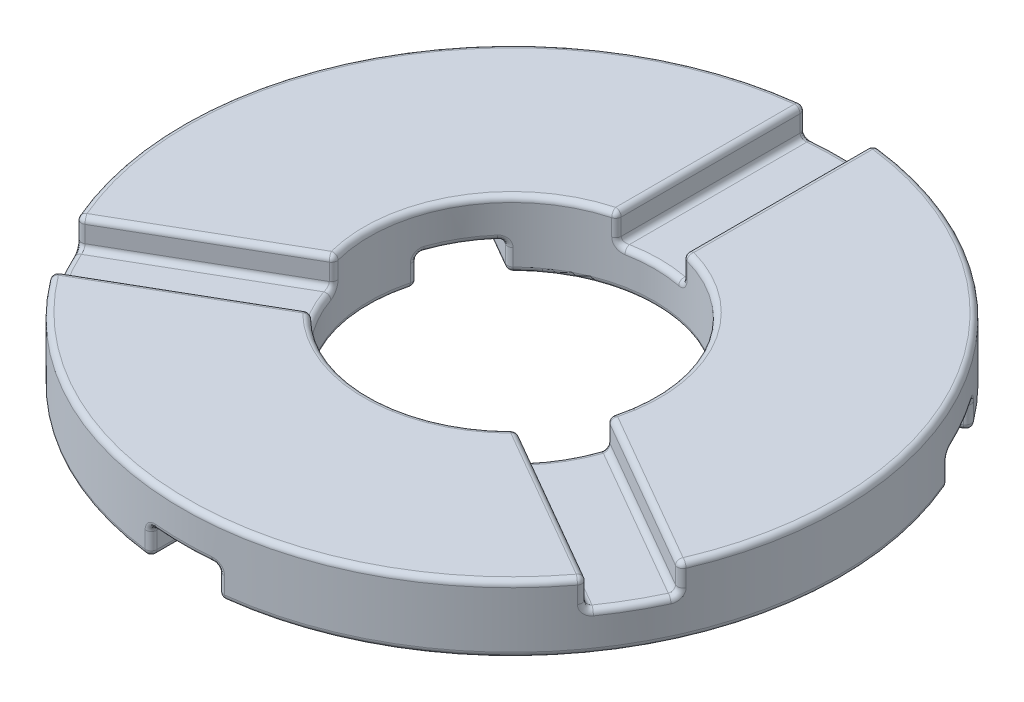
SolidWorks part; units mm, degrees
ref_plane "Front" through (0, 0, 0) normal (0, 0, 1) x (1, 0, 0)
ref_plane "Top" through (0, 0, 0) normal (0, 1, 0) x (1, 0, 0)
ref_plane "Right" through (0, 0, 0) normal (1, 0, 0) x (0, 0, -1)
sketch "Sketch1" plane through (0, 0, 0) normal (0, 1, 0) x (1, 0, 0)
  circle A0 centre (0, 0) radius 7.493
  circle A1 centre (0, 0) radius 3.2385
  dimension "D1" = 14.986
  dimension "D2" = 6.477
extrude "Extrude1" add sketch "Sketch1" along normal blind 1.524
sketch "Sketch2" plane through (0, 0, 0) normal (0, 1, 0) x (1, 0, 0)
  line L1 (-0.762, -8.7767) -> (0.762, -8.7767)
  line L2 (-0.762, -8.7767) -> (-0.762, -1.6166)
  line L3 (-0.762, -1.6166) -> (0.762, -1.6166)
  line L4 (0.762, -8.7767) -> (0.762, -1.6166)
  dimension "D1" = 1.524
  dimension "D2" = 0.762
extrude "Cut-Extrude1" cut sketch "Sketch2" along normal blind 0.635
pattern_circular "CirPattern1" count 3 over 360 about axis through (0, 0, 0) along (0, 1, 0) of "Cut-Extrude1"
sketch "Sketch3" plane through (0, 1.524, 0) normal (0, 1, 0) x (-1, 0, 0)
  line L1 (-0.762, -2.2033) -> (0.762, -2.2033)
  line L2 (-0.762, -2.2033) -> (-0.762, -8.3207)
  line L3 (-0.762, -8.3207) -> (0.762, -8.3207)
  line L4 (0.762, -2.2033) -> (0.762, -8.3207)
  dimension "D1" = 1.524
  dimension "D2" = 0.762
extrude "Cut-Extrude2" cut sketch "Sketch3" against normal blind 0.635
pattern_circular "CirPattern2" count 3 over 360 about axis through (0, 0, 0) along (0, 1, 0) of "Cut-Extrude2"
fillet "Fillet1" radius 0.127 72 edges at (0, 0.635, 3.2385) (0.762, 0.3175, 3.1476) (-0.762, 0.3175, 3.1476) (-0.762, 0, 5.3009) (0.762, 0, 5.3009) (0.762, 0.635, 5.3009) (-0.762, 0.635, 5.3009) (-0.762, 0.3175, 7.4542) (0.762, 0.3175, 7.4542) (6.4891, 0, 3.7465) (0, 0.635, 7.493) (-2.8046, 0, 1.6192) (-6.4891, 0, 3.7465) (-6.8365, 0.3175, -3.0672) (-6.4891, 0.635, -3.7465) (-6.0745, 0.3175, -4.387) (-2.3449, 0.3175, -2.2337) (-4.2097, 0, -3.3103) (-4.9717, 0, -1.9905) (-3.1069, 0.3175, -0.9139) (-4.9717, 0.635, -1.9905) (-2.8046, 0.635, -1.6193) (-4.2097, 0.635, -3.3103) (0, 0, -3.2385) (0, 0, -7.493) (6.0745, 0.3175, -4.387) (2.8046, 0, 1.6193) (6.4891, 0.635, -3.7465) (6.8365, 0.3175, -3.0672) (3.1069, 0.3175, -0.9139) (4.9717, 0, -1.9905) (4.2097, 0, -3.3103) (2.3449, 0.3175, -2.2337) (4.2097, 0.635, -3.3103) (2.8046, 0.635, -1.6192) (4.9717, 0.635, -1.9905) (-6.4891, 1.524, -3.7465) (-2.8046, 1.524, -1.6193) (-0.762, 1.524, -5.3009) (0.762, 1.524, -5.3009) (0, 0.889, -3.2385) (0.762, 0.889, -5.3009) (0.762, 1.2065, -7.4542) (0.762, 1.2065, -3.1476) (-0.762, 1.2065, -7.4542) (-0.762, 0.889, -5.3009) (-0.762, 1.2065, -3.1476) (0, 0.889, -7.493) (2.8046, 1.524, -1.6192) (6.4891, 1.524, -3.7465) (6.4891, 0.889, 3.7465) (3.1069, 1.2065, 0.9139) (2.3449, 1.2065, 2.2337) (4.9717, 1.524, 1.9905) (4.2097, 1.524, 3.3103) (4.2097, 0.889, 3.3103) (6.0745, 1.2065, 4.387) (2.8046, 0.889, 1.6193) (6.8365, 1.2065, 3.0672) (4.9717, 0.889, 1.9905) (0, 1.524, 3.2385) (0, 1.524, 7.493) (-6.4891, 0.889, 3.7465) (-2.3449, 1.2065, 2.2337) (-3.1069, 1.2065, 0.9139) (-4.2097, 1.524, 3.3103) (-4.9717, 1.524, 1.9905) (-4.9717, 0.889, 1.9905) (-6.8365, 1.2065, 3.0672) (-2.8046, 0.889, 1.6192) (-6.0745, 1.2065, 4.387) (-4.2097, 0.889, 3.3103)
